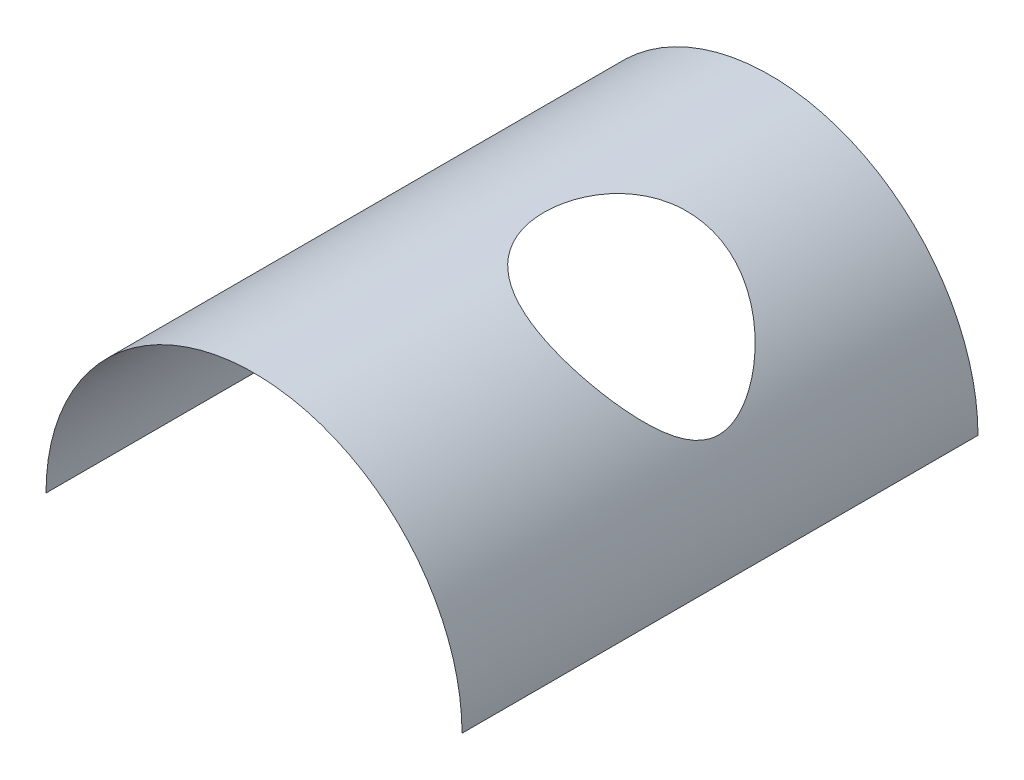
SolidWorks part; units mm, degrees
ref_plane "Front Plane" through (0, 0, 0) normal (0, 0, 1) x (1, 0, 0)
ref_plane "Top Plane" through (0, 0, 0) normal (0, 1, 0) x (1, 0, 0)
ref_plane "Right Plane" through (0, 0, 0) normal (1, 0, 0) x (0, 0, -1)
sketch "Sketch1" plane through (0, 0, 0) normal (0, 0, 1) x (1, 0, 0)
  arc A0 (23.2456, 0) -> (-23.2456, 0) centre (0, 0) ccw
surface "Surface-Extrude1" sketch "Sketch1" parameters "D1"=57.658
sketch "Sketch2" plane through (0, 0, 0) normal (0, 1, 0) x (0, 0, -1)
  arc A0 (40.4673, -5.9929) -> (24.5082, -3.8533) centre (31.75, -10.4261) ccw
  arc A1 (37.4944, -18.341) -> (40.4673, -5.9929) centre (31.75, -10.4261) ccw
  arc A2 (24.5082, -16.9989) -> (37.4944, -18.341) centre (31.75, -10.4261) ccw
  arc A3 (24.5082, -3.8533) -> (24.5082, -16.9989) centre (31.75, -10.4261) ccw
surface "Surface-Trim1"
